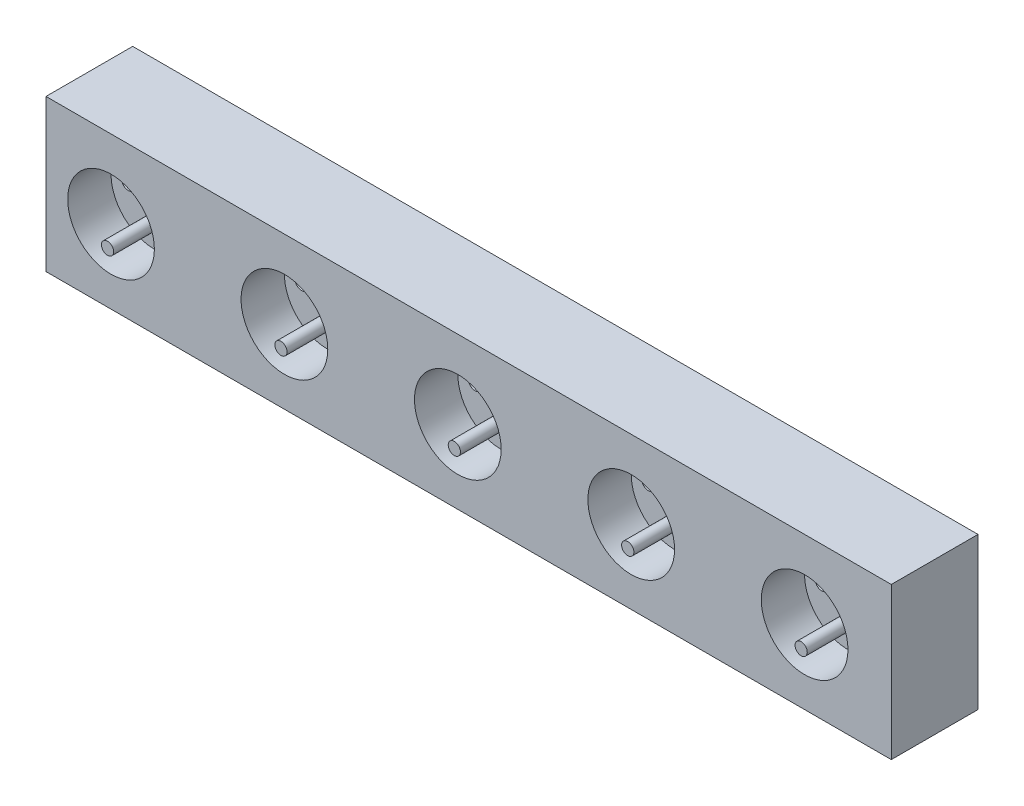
SolidWorks part; units mm, degrees
ref_plane "Face" through (0, 0, 0) normal (0, 0, 1) x (1, 0, 0)
ref_plane "Dessus" through (0, 0, 0) normal (0, 1, 0) x (1, 0, 0)
ref_plane "Droite" through (0, 0, 0) normal (1, 0, 0) x (0, 0, -1)
sketch "Esquisse1" plane through (0, 0, 0) normal (0, 0, 1) x (1, 0, 0)
  line L1 (0, 0) -> (390, 0)
  line L2 (0, 0) -> (0, 70)
  line L3 (0, 70) -> (390, 70)
  line L4 (390, 0) -> (390, 70)
  dimension "D1" = 390
  dimension "D2" = 70
extrude "Extrusion1" add sketch "Esquisse1" along normal blind 40
sketch "Esquisse2" plane through (0, 0, 40) normal (0, 0, 1) x (1, 0, 0)
  line L0 (0, 70) -> (0, 0) construction
  circle A0 centre (30, 33.9456) radius 20
  dimension "D1" = 40
  dimension "D5" = 30
extrude "Extrusion2" cut sketch "Esquisse2" against normal blind 20
sketch "Esquisse3" plane through (0, 0, 20) normal (0, 0, 1) x (1, 0, 0)
  circle A0 centre (17.9088, 34.3765) radius 3
  circle A1 centre (41.6685, 33.5996) radius 3
  dimension "D1" = 6
  dimension "D2" = 6
extrude "Extrusion3" cut sketch "Esquisse3" against normal blind 10
sketch "Esquisse4" plane through (0, 0, 20) normal (0, 0, 1) x (1, 0, 0)
  circle A0 centre (28.4026, 23.5293) radius 2.8242
extrude "Extrusion4" add sketch "Esquisse4" along normal blind 20
pattern_linear "Répétition linéaire1" count 5 spacing 80 along (1, 0, 0) of "Extrusion2", "Extrusion3", "Extrusion4"
